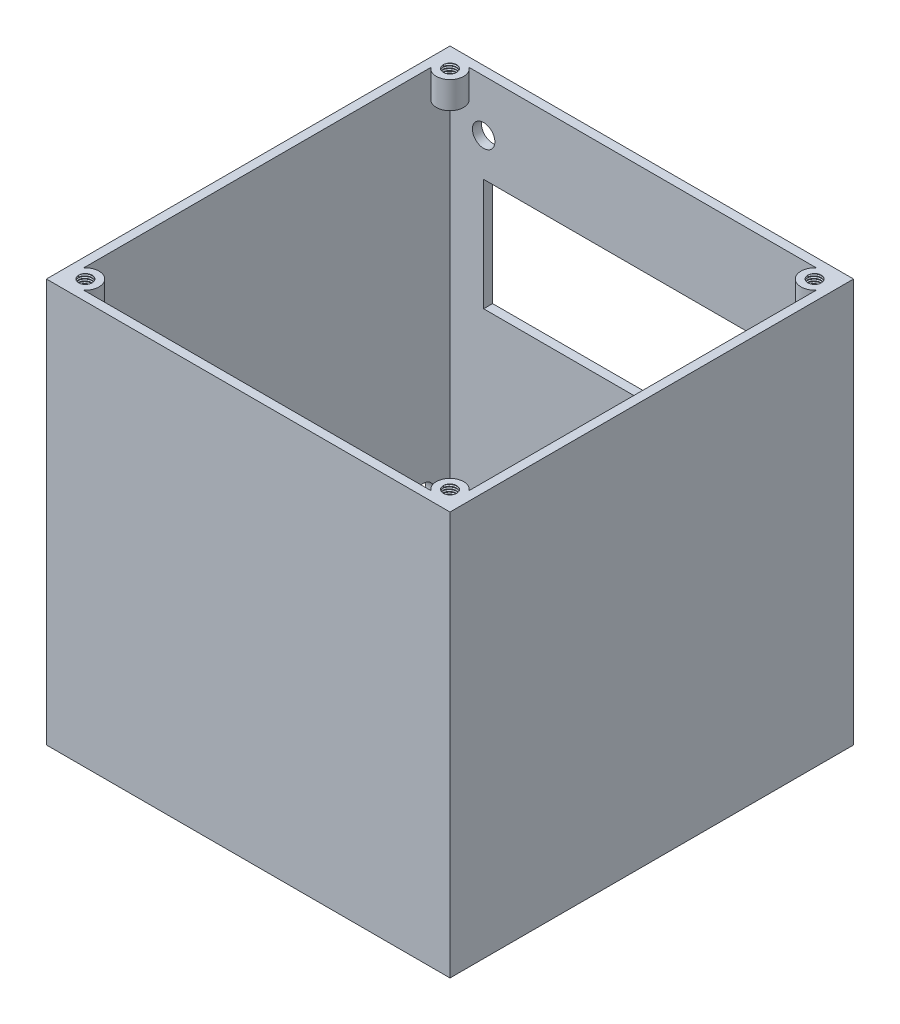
SolidWorks part; units mm, degrees
ref_plane "Front Plane" through (0, 0, 0) normal (0, 0, 1) x (1, 0, 0)
ref_plane "Top Plane" through (0, 0, 0) normal (0, 1, 0) x (1, 0, 0)
ref_plane "Right Plane" through (0, 0, 0) normal (1, 0, 0) x (0, 0, -1)
sketch "Esquisse2" plane through (0, 0, 0) normal (0, 1, 0) x (1, 0, 0)
  line L1 (-45, -45) -> (45, -45)
  line L2 (-45, -45) -> (-45, 45)
  line L3 (-45, 45) -> (45, 45)
  line L4 (45, -45) -> (45, 45)
  line L5 (-45, -45) -> (45, 45) construction
  line L6 (-45, 45) -> (45, -45) construction
  point P0 (0, 0)
  dimension "D1" = 90
  dimension "D2" = 90
extrude "Boss.-Extru.1" add sketch "Esquisse2" along normal blind 90
shell "Coque1" thickness 2
sketch "Esquisse7" plane through (0, 0, -45) normal (0, 0, -1) x (-1, 0, 0)
  line L0 (-45, 0) -> (45, 0) construction
  line L1 (-35.5, 70) -> (35.5, 70)
  line L2 (-35.5, 70) -> (-35.5, 45)
  line L3 (-35.5, 45) -> (35.5, 45)
  line L4 (35.5, 70) -> (35.5, 45)
  circle A0 centre (-35.5, 78.4804) radius 2.5
  circle A1 centre (35.5, 78.4804) radius 2.5
  point P6 (0, 45)
  dimension "D4" = 5
  dimension "D5" = 5
  dimension "D1" = 71
  dimension "D2" = 25
  dimension "D3" = 45
extrude "Enlèv. mat.-Extru.4" cut sketch "Esquisse7" against normal blind 12
sketch "Esquisse9" plane through (-45, 0, 0) normal (-1, 0, 0) x (0, 0, 1)
  line L0 (-45, 0) -> (45, 0) construction
  line L1 (-45, 90) -> (-45, 0) construction
  circle A0 centre (-37, 8) radius 2.5
  dimension "D1" = 5
  dimension "D2" = 8
  dimension "D3" = 8
extrude "Enlèv. mat.-Extru.5" cut sketch "Esquisse9" against normal blind 12
sketch "Esquisse10" plane through (0, 90, 0) normal (0, 1, 0) x (1, 0, 0)
  line L10 (43, 43) -> (-43, 43) construction
  line L11 (-43, 43) -> (-43, -43) construction
  line L12 (43, 43) -> (-43, 43) construction
  line L13 (-43, 43) -> (-43, -43) construction
  line L14 (-38.7286, 43) -> (-43, 43)
  line L15 (-43, 43) -> (-43, 38.7286)
  line L16 (-12.2735, 0) -> (0, 0) construction
  line L17 (0, 0) -> (0, -11.6201) construction
  line L18 (-43, -43) -> (-43, -38.7286)
  line L19 (-38.7286, -43) -> (-43, -43)
  line L20 (38.7286, -43) -> (43, -43)
  line L21 (43, -43) -> (43, -38.7286)
  line L22 (43, 43) -> (43, 38.7286)
  line L23 (38.7286, 43) -> (43, 43)
  line L24 (45, 45) -> (-45, 45) construction
  line L25 (-45, 45) -> (-45, -45) construction
  circle A4 centre (-40.65, 40.65) radius 1.5
  arc A5 (-38.7286, 43) -> (-43, 38.7286) centre (-40.65, 40.65) cw
  arc A6 (-38.7286, -43) -> (-43, -38.7286) centre (-40.65, -40.65) ccw
  circle A7 centre (-40.65, -40.65) radius 1.5
  circle A8 centre (40.65, -40.65) radius 1.5
  arc A9 (38.7286, -43) -> (43, -38.7286) centre (40.65, -40.65) cw
  arc A10 (38.7286, 43) -> (43, 38.7286) centre (40.65, 40.65) ccw
  circle A11 centre (40.65, 40.65) radius 1.5
  dimension "D2" = 4.35
  dimension "D6" = 3
  dimension "D1" = 4.35
extrude "Boss.-Extru.2" add sketch "Esquisse10" against normal blind 6
thread "Filetage1" pitch 0.5 start angle 0, offset 0, length 10, pitch 0.5, diameter 3
ref_plane "Plan1" through (-42.15, 90, 40.65) normal (0, 0, 1) x (-1, 0, 0)
sketch "Profil de filetage1" plane through (-42.15, 90, 40.65) normal (0, 0, 1) x (-1, 0, 0)
  line L0 (0, 0) -> (0, 0.5) construction
  line L1 (0, 0) -> (0.2706, 0.1562)
  line L2 (0.2706, 0.1562) -> (0.2706, 0.2187)
  line L3 (0.2706, 0.2187) -> (0, 0.375)
  line L4 (0.2706, 0.1875) -> (0, 0.1875) construction
  line L11 (0, 0) -> (0, 0.375)
  point P2 (0, 0)
  dimension "Pitch" = 0.5
  dimension "Profile_Angle" = 60
  dimension "Profile_Land" = 0.0625
  dimension "Profile_Height" = 0.2706
thread "Filetage2" pitch 0.5 start angle 0, offset 0, length 10, pitch 0.5, diameter 3
ref_plane "Plan2" through (-42.15, 90, -40.65) normal (0, 0, 1) x (-1, 0, 0)
sketch "Profil de filetage2" plane through (-42.15, 90, -40.65) normal (0, 0, 1) x (-1, 0, 0)
  line L0 (0, 0) -> (0, 0.5) construction
  line L1 (0, 0) -> (0.2706, 0.1562)
  line L2 (0.2706, 0.1562) -> (0.2706, 0.2187)
  line L3 (0.2706, 0.2187) -> (0, 0.375)
  line L4 (0.2706, 0.1875) -> (0, 0.1875) construction
  line L11 (0, 0) -> (0, 0.375)
  point P2 (0, 0)
  dimension "Pitch" = 0.5
  dimension "Profile_Angle" = 60
  dimension "Profile_Land" = 0.0625
  dimension "Profile_Height" = 0.2706
thread "Filetage3" pitch 0.5 start angle 0, offset 0, length 10, pitch 0.5, diameter 3
ref_plane "Plan3" through (39.15, 90, 40.65) normal (0, 0, 1) x (-1, 0, 0)
sketch "Profil de filetage3" plane through (39.15, 90, 40.65) normal (0, 0, 1) x (-1, 0, 0)
  line L0 (0, 0) -> (0, 0.5) construction
  line L1 (0, 0) -> (0.2706, 0.1562)
  line L2 (0.2706, 0.1562) -> (0.2706, 0.2187)
  line L3 (0.2706, 0.2187) -> (0, 0.375)
  line L4 (0.2706, 0.1875) -> (0, 0.1875) construction
  line L11 (0, 0) -> (0, 0.375)
  point P2 (0, 0)
  dimension "Pitch" = 0.5
  dimension "Profile_Angle" = 60
  dimension "Profile_Land" = 0.0625
  dimension "Profile_Height" = 0.2706
thread "Filetage4" pitch 0.5 start angle 0, offset 0, length 10, pitch 0.5, diameter 3
ref_plane "Plan4" through (39.15, 90, -40.65) normal (0, 0, 1) x (-1, 0, 0)
sketch "Profil de filetage4" plane through (39.15, 90, -40.65) normal (0, 0, 1) x (-1, 0, 0)
  line L0 (0, 0) -> (0, 0.5) construction
  line L1 (0, 0) -> (0.2706, 0.1562)
  line L2 (0.2706, 0.1562) -> (0.2706, 0.2187)
  line L3 (0.2706, 0.2187) -> (0, 0.375)
  line L4 (0.2706, 0.1875) -> (0, 0.1875) construction
  line L11 (0, 0) -> (0, 0.375)
  point P2 (0, 0)
  dimension "Pitch" = 0.5
  dimension "Profile_Angle" = 60
  dimension "Profile_Land" = 0.0625
  dimension "Profile_Height" = 0.2706
